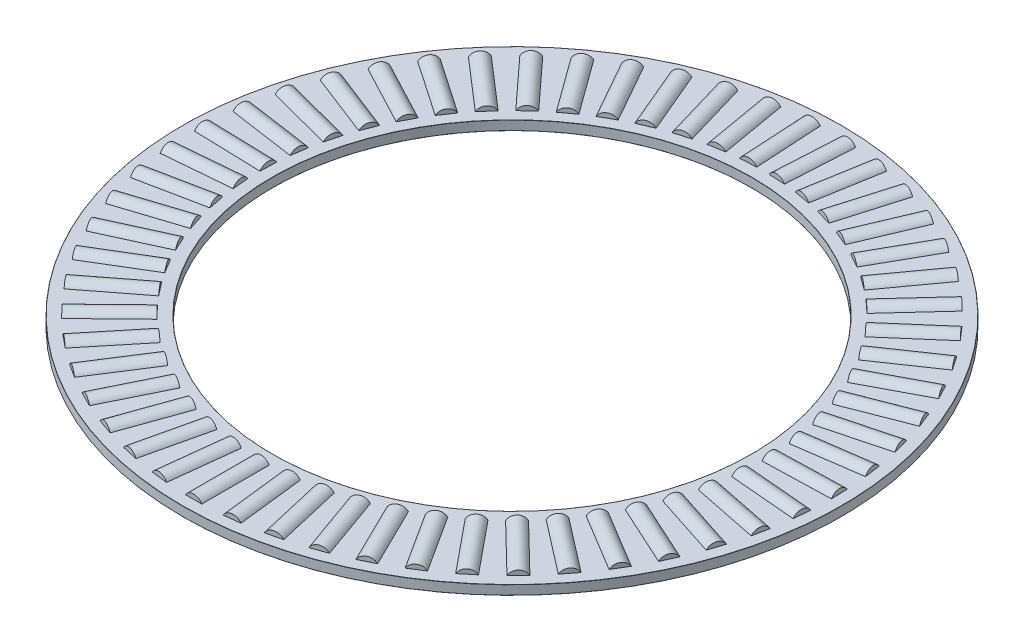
SolidWorks part; units mm, degrees
ref_plane "Front Plane" through (0, 0, 0) normal (0, 0, 1) x (1, 0, 0)
ref_plane "Top Plane" through (0, 0, 0) normal (0, 1, 0) x (1, 0, 0)
ref_plane "Right Plane" through (0, 0, 0) normal (1, 0, 0) x (0, 0, -1)
sketch "Sketch1" plane through (0, 0, 0) normal (1, 0, 0) x (0, 0, -1)
  line L0 (-34.925, 0) -> (34.925, 0) construction
  line L1 (0, -0.9922) -> (0, 0.9922) construction
  line L2 (-34.925, 0.4961) -> (-25.4, 0.4961)
  line L3 (-34.925, 0.4961) -> (-34.925, -0.4961)
  line L4 (-34.925, -0.4961) -> (-25.4, -0.4961)
  line L5 (-25.4, 0.4961) -> (-25.4, -0.4961)
  line L7 (-30.1625, 0.9922) -> (-30.1625, 0.4961) construction
  line L8 (-33.7344, 0.9922) -> (-26.5906, 0.9922) construction
  line L9 (-33.7344, 0.9922) -> (-33.7344, -0.9922) construction
  line L10 (-33.7344, -0.9922) -> (-26.5906, -0.9922) construction
  line L11 (-26.5906, 0.9922) -> (-26.5906, -0.9922) construction
  point P16 (-33.7344, 0)
  dimension "D1" = 7.1437
  dimension "OD" = 69.85
  dimension "Shaft Dia" = 50.8
  dimension "Th" = 1.9844
  dimension "D2" = 0.9922
  dimension "D3" = 9.525
revolve "Revolve1" add sketch "Sketch1" angle 360 about L1
sketch "Sketch3" plane through (0, 0, 0) normal (1, 0, 0) x (0, 0, -1)
  line L0 (-33.7344, 0.9922) -> (-33.7344, -0.9922) construction
  line L1 (-33.7344, 0) -> (-26.5906, 0)
  line L2 (-33.7344, 0) -> (-33.7344, 0.9922)
  line L3 (-33.7344, 0.9922) -> (-26.5906, 0.9922)
  line L4 (-26.5906, 0) -> (-26.5906, 0.9922)
revolve "Cut-Revolve1" cut sketch "Sketch3" angle 360 about L1
sketch "Sketch2" plane through (0, 0, 0) normal (1, 0, 0) x (0, 0, -1)
  line L1 (-33.7344, 0) -> (-26.5906, 0)
  line L2 (-33.7344, 0) -> (-33.7344, 0.9922)
  line L3 (-33.7344, 0.9922) -> (-26.5906, 0.9922)
  line L4 (-26.5906, 0) -> (-26.5906, 0.9922)
revolve "Revolve2" add sketch "Sketch2" angle 360 about L1
ref_axis "Axis1" through (0, 0.9922, 0) along (0, -1, 0)
pattern_circular "CirPattern1" count 55 every 6.545 about axis through (0, 0.9922, 0) along (0, -1, 0)
pattern_circular "CirPattern2" count 55 every 6.545 about axis through (0, 0, 0) along (0, 1, 0) of "Cut-Revolve1"
sketch "Sketch4" plane through (0, 0, 0) normal (1, 0, 0) x (0, 0, -1)
  line L0 (-34.925, 0.4961) -> (-34.925, -0.4961) construction
  line L1 (-34.925, 9.1091) -> (-25.4, 9.1091)
  line L2 (-34.925, 9.1091) -> (-34.925, 9.9219)
  line L3 (-34.925, 9.9219) -> (-25.4, 9.9219)
  line L4 (-25.4, 9.1091) -> (-25.4, 9.9219)
  line L5 (-34.925, -9.9219) -> (-25.4, -9.9219)
  line L6 (-34.925, -9.9219) -> (-34.925, -9.1091)
  line L7 (-34.925, -9.1091) -> (-25.4, -9.1091)
  line L8 (-25.4, -9.9219) -> (-25.4, -9.1091)
  line L10 (-25.4, 0.4961) -> (-25.4, -0.4961) construction
  line L11 (0, 0) -> (-34.925, 0) construction
  line L12 (-34.925, 0) -> (34.925, 0) construction
  line L13 (0, -0.9922) -> (0, 0.9922) construction
  dimension "Ht" = 19.8438
  dimension "Washer Th" = 0.8128
  dimension "Washer ID" = 50.8
  dimension "Washer OD" = 69.85
revolve "Revolve3" [suppressed] add sketch "Sketch4" angle 360 about L1
fillet "Fillet1" [suppressed] radius 0.0198
fillet "Fillet2" radius 0.0198 4 edges at (0, -0.4961, -25.4) (0, 0.4961, -25.4) (0, -0.4961, -34.925) (0, 0.4961, -34.925)
fillet "Fillet3" [suppressed] radius 0.0198
equation "\"D2@Sketch1\" = \"Th@Sketch1\"*.5"
equation "\"D1@Fillet1\" = \"Th@Sketch1\"*.01"
equation "\"D1@Fillet2\" = \"D1@Fillet1\""
equation "\"D1@Fillet3\" = \"D1@Fillet1\""
equation "\"D1@Sketch1\" = \"D3@Sketch1\"*.75"
equation "\"Angle@CirPattern1\" = 360/\"Rollers@CirPattern1\""
equation "\"Rollers@CirPattern1\" = \"OD@Sketch1\"*20"
equation "\"D1@CirPattern2\" = \"Rollers@CirPattern1\""
equation "\"D2@CirPattern2\" = \"Angle@CirPattern1\""
equation "\"Ht@Sketch4\" = \"Th@Sketch1\"*10"
